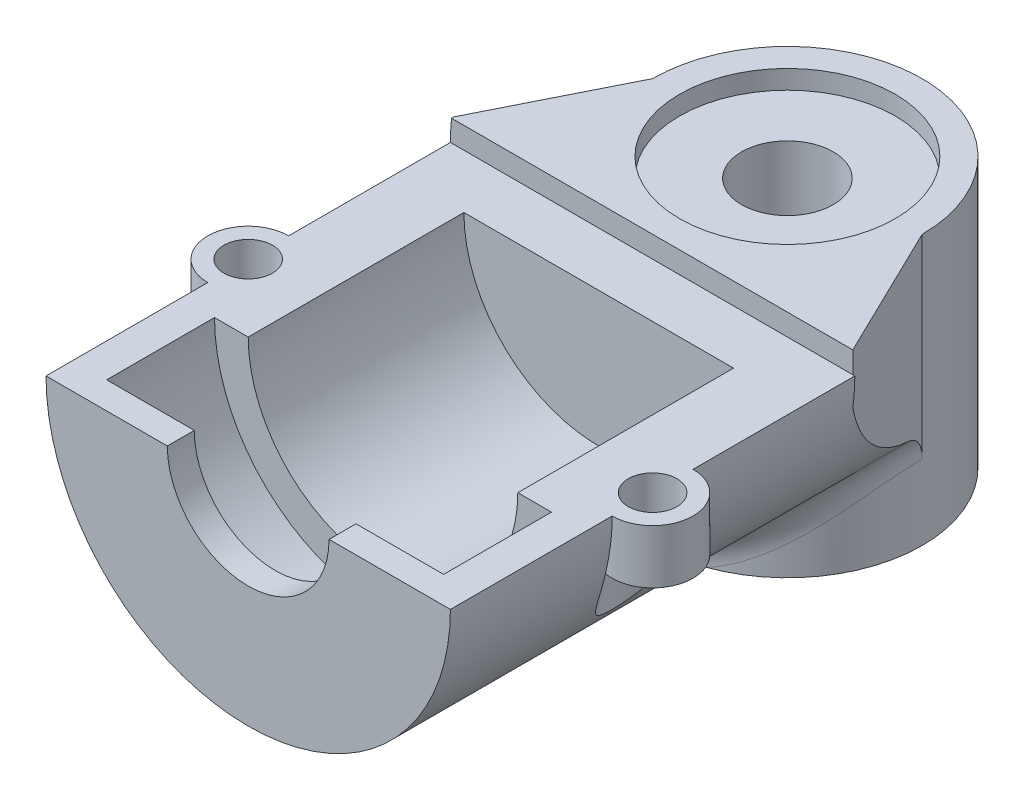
SolidWorks part; units mm, degrees
ref_plane "Front Plane" through (0, 0, 0) normal (0, 0, 1) x (1, 0, 0)
ref_plane "Top Plane" through (0, 0, 0) normal (0, 1, 0) x (1, 0, 0)
ref_plane "Right Plane" through (0, 0, 0) normal (1, 0, 0) x (0, 0, -1)
sketch "Sketch1" plane through (0, 0, 0) normal (0, 0, 1) x (1, 0, 0)
  circle A0 centre (0, 0) radius 9.525
  dimension "D1" = 19.05
extrude "Boss-Extrude1" add sketch "Sketch1" along normal blind 31.75
sketch "Sketch2" plane through (0, 0, 0) normal (0, 1, 0) x (1, 0, 0)
  line L0 (9.525, 0) -> (-9.525, 0) construction
  circle A0 centre (0, -6.35) radius 6.35
  dimension "D1" = 12.7
  dimension "D2" = 6.35
extrude "Boss-Extrude3" add sketch "Sketch2" along normal mid plane 19.05
sketch "Sketch3" plane through (0, 0, 0) normal (0, 1, 0) x (1, 0, 0)
  line L0 (-6.35, -6.35) -> (-9.525, -12.7)
  line L1 (-9.525, 0) -> (-9.525, -31.75) construction
  line L2 (-9.525, -12.7) -> (-12.728, -12.7)
  line L3 (-12.728, -12.7) -> (-12.728, 2.5774)
  line L4 (-12.728, 2.5774) -> (12.728, 2.5774)
  line L5 (12.728, 2.5774) -> (12.728, -12.7)
  line L6 (12.728, -12.7) -> (9.4319, -12.7)
  line L8 (6.35, -6.35) -> (9.4319, -12.7)
  arc A1 (6.35, -6.35) -> (-6.35, -6.35) centre (0, -6.35) ccw
extrude "Cut-Extrude1" cut sketch "Sketch3" against normal mid plane 19.05
sketch "Sketch17" plane through (0, 0, 0) normal (0, 1, 0) x (1, 0, 0)
  circle A0 centre (0, -6.35) radius 6.35
extrude "Boss-Extrude5" add sketch "Sketch17" against normal blind 10.16
sketch "Sketch18" plane through (0, 0, 0) normal (1, 0, 0) x (0, 0, -1)
  line L0 (-12.7, -10.16) -> (0, -10.16) construction
  line L1 (0.619, 11.9651) -> (-12.6697, 11.9651)
  line L2 (0.619, 11.9651) -> (0.619, 2.54)
  line L3 (0.619, 2.54) -> (-12.7, 2.54)
  line L5 (-12.7, 2.54) -> (-14.732, 9.525)
  line L6 (-12.7, 9.525) -> (-31.75, 9.525) construction
  line L7 (-14.732, 9.525) -> (-14.732, 11.9651)
  line L8 (-14.732, 11.9651) -> (-12.6697, 11.9651)
  dimension "D1" = 12.7
  dimension "D2" = 2.032
  dimension "D3" = 12.7
extrude "Cut-Extrude9" cut sketch "Sketch18" against normal through all both and the other way through all
sketch "Sketch19" plane through (0, -10.16, 0) normal (0, -1, 0) x (1, 0, 0)
  circle A0 centre (0, 6.35) radius 2.159
  dimension "D1" = 4.318
extrude "Cut-Extrude10" cut sketch "Sketch19" against normal through all
sketch "Sketch21" plane through (0, 0, 0) normal (1, 0, 0) x (0, 0, -1)
  line L0 (-33.0568, 0) -> (-12.7, 0)
  line L1 (-12.7, -1.3285) -> (-12.7, 1.3285) construction
  line L2 (-12.7, 0) -> (-12.7, 11.6956)
  line L3 (-12.7, 11.6956) -> (-33.0568, 11.6956)
  line L4 (-33.0568, 11.6956) -> (-33.0568, 0)
extrude "Cut-Extrude11" cut sketch "Sketch21" against normal through all both and the other way through all
sketch "Sketch22" plane through (0, 0, 0) normal (0, 1, 0) x (1, 0, 0)
  line L0 (7.9375, -30.48) -> (3.81, -30.48)
  line L1 (3.81, -30.48) -> (3.81, -31.75)
  line L2 (-9.525, -31.75) -> (9.525, -31.75) construction
  line L3 (3.81, -31.75) -> (0, -31.75)
  line L4 (7.9375, -30.48) -> (7.9375, -25.4)
  line L5 (7.9375, -25.4) -> (6.35, -25.4)
  line L6 (6.35, -25.4) -> (6.35, -15.24)
  line L7 (6.35, -15.24) -> (0, -15.24)
  line L8 (0, -31.75) -> (0, -15.24) construction
  line L9 (0, -31.75) -> (0, -15.24)
  dimension "D1" = 1.27
  dimension "D2" = 5.08
  dimension "D3" = 10.16
  dimension "D4" = 6.35
  dimension "D5" = 7.9375
  dimension "D6" = 3.81
revolve "Cut-Revolve1" cut sketch "Sketch22" angle 360 about L8
sketch "Sketch23" plane through (0, 0, 0) normal (0, 1, 0) x (1, 0, 0)
  line L0 (-9.525, -31.75) -> (-9.525, -12.7) construction
  line L1 (9.525, -31.75) -> (9.525, -12.7) construction
  circle A0 centre (-9.525, -22.225) radius 1.905
  circle A1 centre (9.525, -22.225) radius 1.905
  dimension "D1" = 3.81
extrude "Boss-Extrude7" add sketch "Sketch23" against normal blind 2.54
sketch "Sketch24" plane through (0, -2.54, 0) normal (0, -1, 0) x (-1, 0, 0)
  circle A0 centre (9.525, -22.225) radius 1.905
  circle A1 centre (-9.525, -22.225) radius 1.905
extrude "Cut-Extrude12" cut sketch "Sketch24" along normal through all
sketch "Sketch25" plane through (0, 0, 0) normal (0, 1, 0) x (1, 0, 0)
  circle A0 centre (-9.525, -22.225) radius 1.143
  circle A1 centre (9.525, -22.225) radius 1.143
  dimension "D1" = 2.286
extrude "Cut-Extrude13" cut sketch "Sketch25" against normal through all
sketch "Sketch33" plane through (0, 2.54, 0) normal (0, 1, 0) x (1, 0, 0)
  line L1 (-13.3429, 1.9509) -> (15.4676, 1.9509)
  line L2 (-13.3429, 1.9509) -> (-13.3429, -14.4515)
  line L3 (-13.3429, -14.4515) -> (15.4676, -14.4515)
  line L4 (15.4676, 1.9509) -> (15.4676, -14.4515)
extrude "Cut-Extrude17" cut sketch "Sketch33" against normal offset from surface (1.524 mm away) 1.016
sketch "Sketch34" plane through (0, 1.016, 0) normal (0, 1, 0) x (1, 0, 0)
  circle A0 centre (0, -6.35) radius 6.35
  circle A1 centre (0, -6.35) radius 2.159
extrude "Boss-Extrude9" add sketch "Sketch34" against normal blind 12.7
fillet "Fillet2" radius 2.54 1 edges at (1.0484, -9.4671, 12.6129)
sketch "Sketch35" plane through (0, 1.016, 0) normal (0, 1, 0) x (1, 0, 0)
  circle A0 centre (0, -6.35) radius 5.08
  dimension "D1" = 10.16
extrude "Cut-Extrude18" cut sketch "Sketch35" against normal blind 0.889
sketch "Sketch36" plane through (0, -11.684, 0) normal (0, -1, 0) x (1, 0, 0)
  circle A0 centre (0, 6.35) radius 5.08
  dimension "D1" = 10.16
extrude "Cut-Extrude19" cut sketch "Sketch36" against normal blind 0.889
